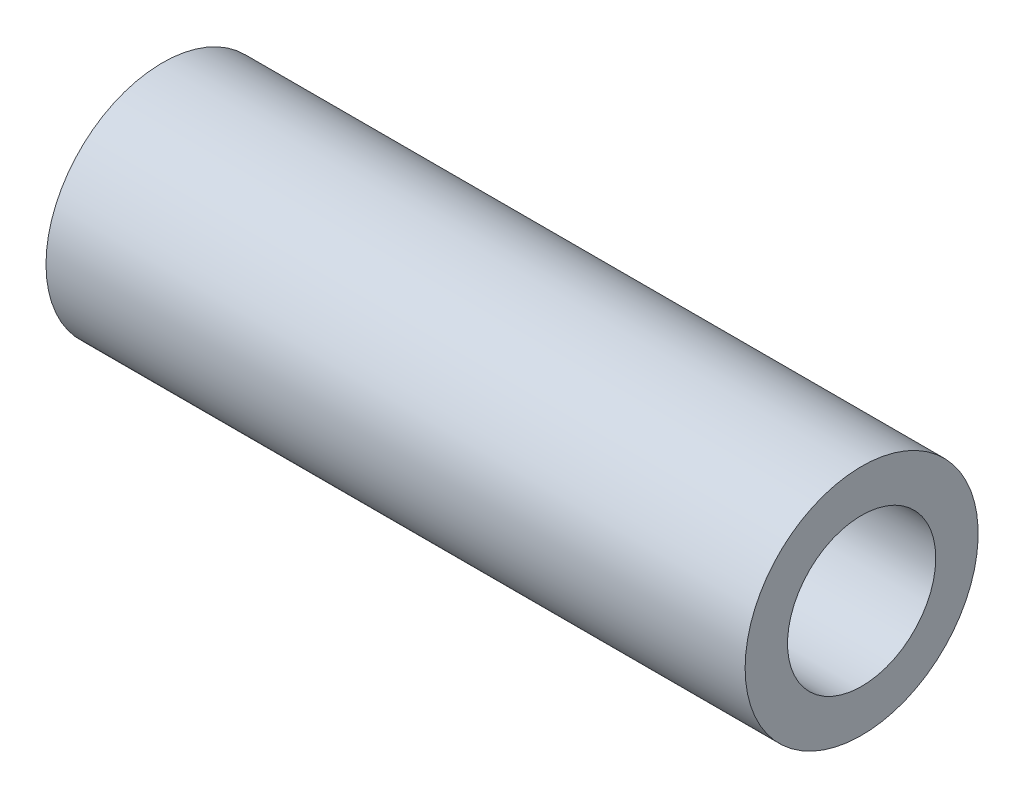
SolidWorks part; units mm, degrees
ref_plane "Front Plane" through (0, 0, 0) normal (0, 0, 1) x (1, 0, 0)
ref_plane "Top Plane" through (0, 0, 0) normal (0, 1, 0) x (1, 0, 0)
ref_plane "Right Plane" through (0, 0, 0) normal (1, 0, 0) x (0, 0, -1)
sketch "Sketch2" plane through (0, 0, 0) normal (1, 0, 0) x (0, 0, -1)
  circle A0 centre (0, 0) radius 3.175
  circle A1 centre (0, 0) radius 1.3525 construction
  dimension "D1" = 6.35
  dimension "D2" = 2.7051
extrude "Boss-Extrude1" add sketch "Sketch2" along normal mid plane 19.05
sketch "Sketch3" plane through (9.525, 0, 0) normal (1, 0, 0) x (0, 0, -1)
  circle A0 centre (0, 0) radius 2.0193
  dimension "D1" = 4.0386
extrude "Cut-Extrude1" cut sketch "Sketch3" against normal through all
